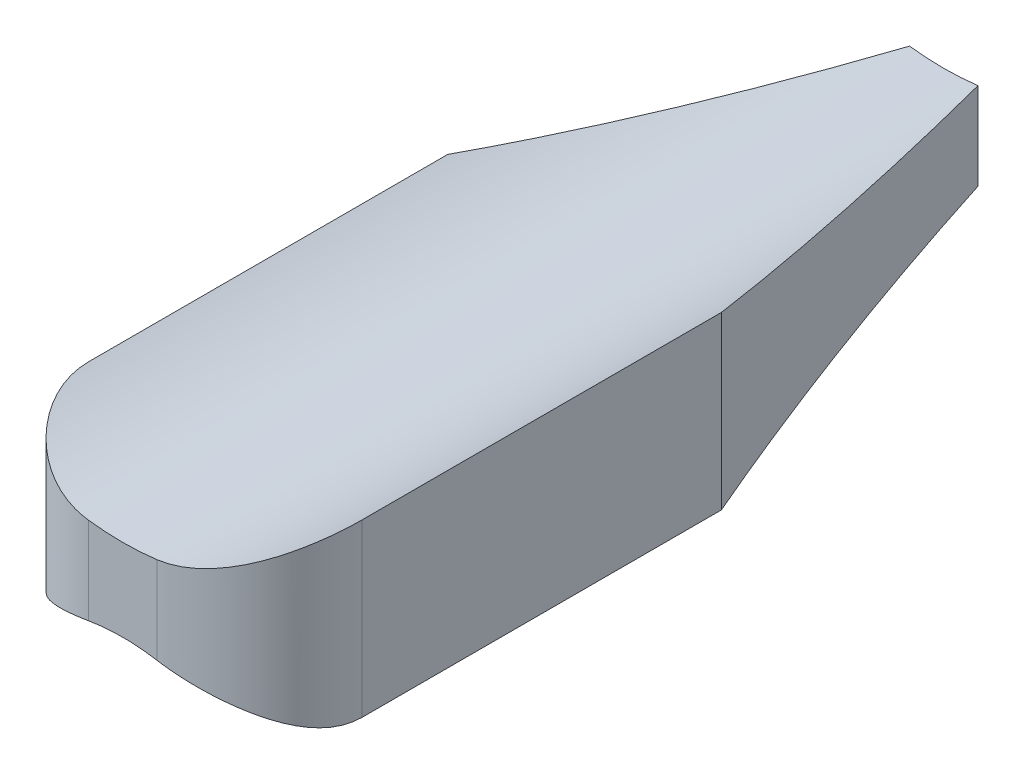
SolidWorks part; units mm, degrees
ref_plane "Front Plane" through (0, 0, 0) normal (0, 0, 1) x (1, 0, 0)
ref_plane "Top Plane" through (0, 0, 0) normal (0, 1, 0) x (1, 0, 0)
ref_plane "Right Plane" through (0, 0, 0) normal (1, 0, 0) x (0, 0, -1)
sketch "Sketch1" plane through (0, 0, 0) normal (0, 0, 1) x (1, 0, 0)
  line L1 (0, 0) -> (101.6, 0)
  line L2 (0, 0) -> (0, 63.5)
  line L3 (0, 63.5) -> (101.6, 63.5)
  line L4 (101.6, 0) -> (101.6, 63.5)
  dimension "D1" = 63.5
  dimension "D2" = 101.6
extrude "Boss-Extrude1" add sketch "Sketch1" along normal blind 304.8
sketch "Sketch2" plane through (0, 0, 304.8) normal (0, 0, 1) x (1, 0, 0)
  line L2 (0, 63.5) -> (0, 0) construction
  circle A0 centre (50.8, 151.4882) radius 101.6
  dimension "D1" = 203.2
  dimension "D2" = 50.8
extrude "Cut-Extrude1" cut sketch "Sketch2" against normal through all
sketch "Sketch3" plane through (0, 0, 304.8) normal (0, 0, 1) x (1, 0, 0)
  line L0 (0, 63.5) -> (0, 0) construction
  circle A0 centre (50.8, -56.7961) radius 76.2
  dimension "D1" = 152.4
  dimension "D2" = 50.8
extrude "Cut-Extrude2" cut sketch "Sketch3" against normal through all
fillet "Fillet1" radius 38.1 2 edges at (0, 31.75, 304.8) (101.6, 31.75, 304.8)
sketch "Sketch4" plane through (0, 0, 0) normal (0, 1, 0) x (1, 0, 0)
  line L0 (0, -133.35) -> (38.1, 0)
  line L1 (0, -266.7) -> (0, 0) construction
  line L2 (101.6, 0) -> (0, 0) construction
  line L3 (101.6, -133.35) -> (63.5, 0)
  line L4 (101.6, -266.7) -> (101.6, 0) construction
  line L5 (38.1, 0) -> (0, 0)
  line L6 (0, 0) -> (0, -133.35)
  line L7 (63.5, 0) -> (101.6, 0)
  line L8 (101.6, 0) -> (101.6, -133.35)
  dimension "D1" = 38.1
  dimension "D2" = 38.1
extrude "Cut-Extrude3" cut sketch "Sketch4" along normal through all
